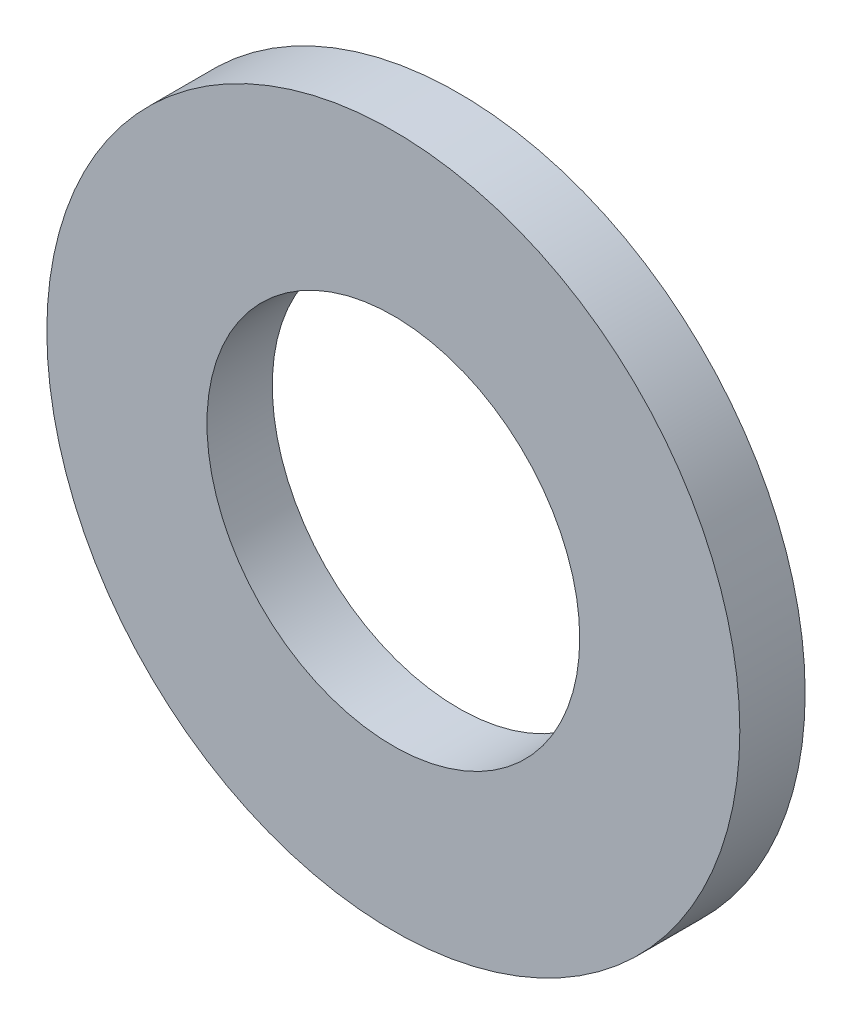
SolidWorks part; units mm, degrees
ref_plane "Front Plane" through (0, 0, 0) normal (0, 0, 1) x (1, 0, 0)
ref_plane "Top Plane" through (0, 0, 0) normal (0, 1, 0) x (1, 0, 0)
ref_plane "Right Plane" through (0, 0, 0) normal (1, 0, 0) x (0, 0, -1)
sketch "Sketch1" plane through (0, 0, 0) normal (0, 0, 1) x (1, 0, 0)
  circle A0 centre (0, 0) radius 7.9
  circle A1 centre (0, 0) radius 4.25
  dimension "D1" = 15.8
  dimension "D2" = 8.5
extrude "Boss-Extrude2" add sketch "Sketch1" along normal blind 1.49
